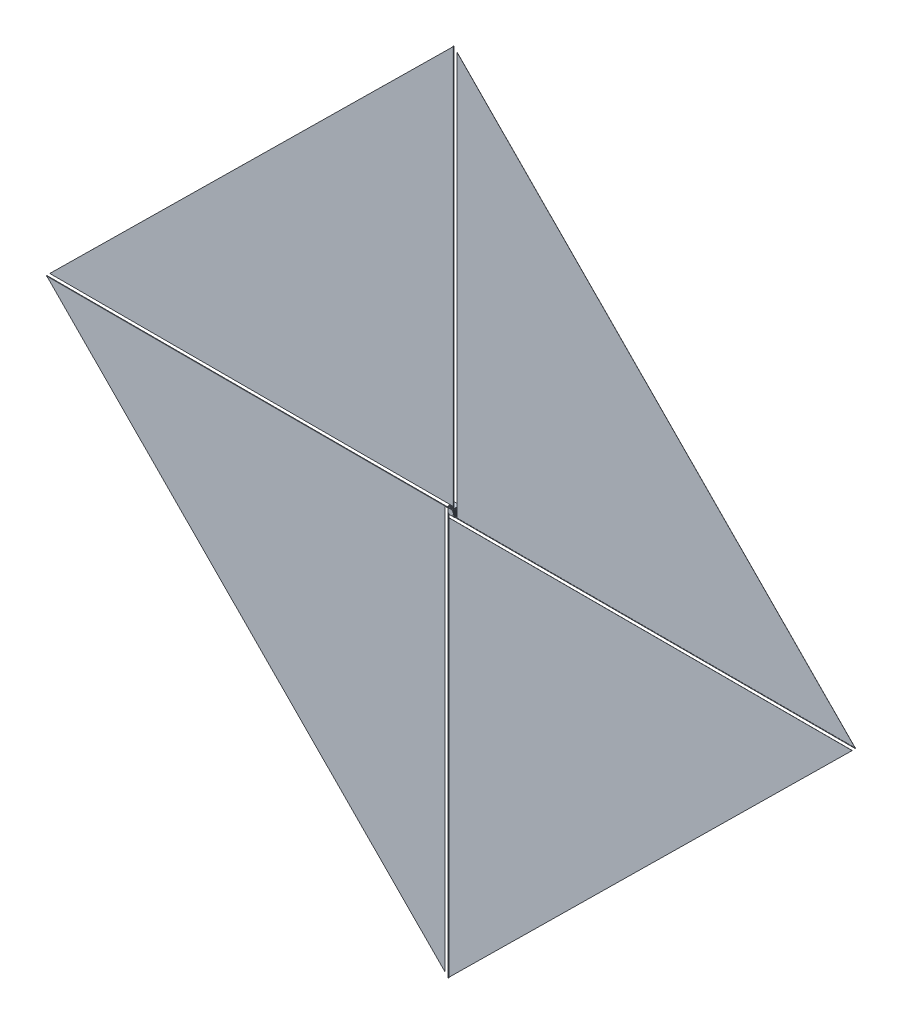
SolidWorks part; units mm, degrees
ref_plane "Front Plane" through (0, 0, 0) normal (0, 0, 1) x (1, 0, 0)
ref_plane "Top Plane" through (0, 0, 0) normal (0, 1, 0) x (1, 0, 0)
ref_plane "Right Plane" through (0, 0, 0) normal (1, 0, 0) x (0, 0, -1)
sketch "Sketch1" plane through (0, 0, 0) normal (0, 0, 1) x (1, 0, 0)
  line L1 (0, 0) -> (250, 0)
  line L2 (0, 0) -> (0, 250)
  line L3 (0, 250) -> (250, 250)
  line L4 (250, 0) -> (250, 250)
  dimension "D1" = 250
  dimension "D2" = 250
extrude "Boss-Extrude1" add sketch "Sketch1" along normal blind 250
sketch "Sketch2" plane through (0, 250, 0) normal (0, 1, 0) x (1, 0, 0)
  line L0 (0, -250) -> (0, 0) construction
  line L1 (25, -225) -> (225, -225)
  line L2 (25, -225) -> (25, -25)
  line L3 (25, -25) -> (225, -25)
  line L4 (225, -225) -> (225, -25)
  line L5 (250, 0) -> (0, 0) construction
  dimension "D1" = 200
  dimension "D2" = 200
  dimension "D3" = 25
  dimension "D4" = 25
extrude "Boss-Extrude2" add sketch "Sketch2" along normal blind 25
pattern_circular "CirPattern1" count 4 every 90 about axis through (125, 125, 0) along (0, 0, 1) of "Boss-Extrude2"
ref_plane "Plane1" through (0, 125, 0) normal (0, 1, 0) x (1, 0, 0)
sketch "Sketch5" plane through (0, 125, 0) normal (0, 1, 0) x (1, 0, 0)
  line L0 (250, -250) -> (0, -250) construction
  line L1 (125, -250) -> (225, -250)
  line L2 (125, -250) -> (125, -275)
  line L3 (125, -275) -> (225, -275)
  line L4 (225, -250) -> (225, -275)
  dimension "D1" = 100
  dimension "D2" = 25
revolve "Revolve1" add sketch "Sketch5" angle 360 about L2
sketch "Sketch6" plane through (0, 125, 0) normal (0, 1, 0) x (1, 0, 0)
  line L0 (25, -275) -> (225, -275) construction
  line L1 (220, -255) -> (205, -255)
  line L2 (220, -255) -> (220, -270)
  line L3 (220, -270) -> (205, -270)
  line L4 (205, -255) -> (205, -270)
  line L5 (225, -275) -> (225, -250) construction
  dimension "D1" = 15
  dimension "D2" = 15
  dimension "D3" = 5
  dimension "D4" = 5
extrude "Boss-Extrude4" add sketch "Sketch6" along normal blind 15000
pattern_circular "CirPattern2" count 4 over 360 about axis through (125, 125, 0) along (0, 0, 1) of "Boss-Extrude4"
sketch "Sketch7" plane through (0, 0, 270) normal (0, 0, 1) x (1, 0, 0)
  line L0 (-14857.5299, 205) -> (-97.7218, -14749.9563)
  line L1 (-14875, 205) -> (65, 205) construction
  line L2 (-97.7218, -14749.9563) -> (-97.7218, 205)
  line L3 (-14857.5299, 205) -> (-97.7218, 205)
extrude "Boss-Extrude5" add sketch "Sketch7" against normal blind 4 from offset 6
pattern_circular "CirPattern3" count 4 over 360 about axis through (125, 125, 0) along (0, 0, 1) of "Boss-Extrude5"
scale "Scale1" scale about centroid uniform scaling yes scale factor 0.5
